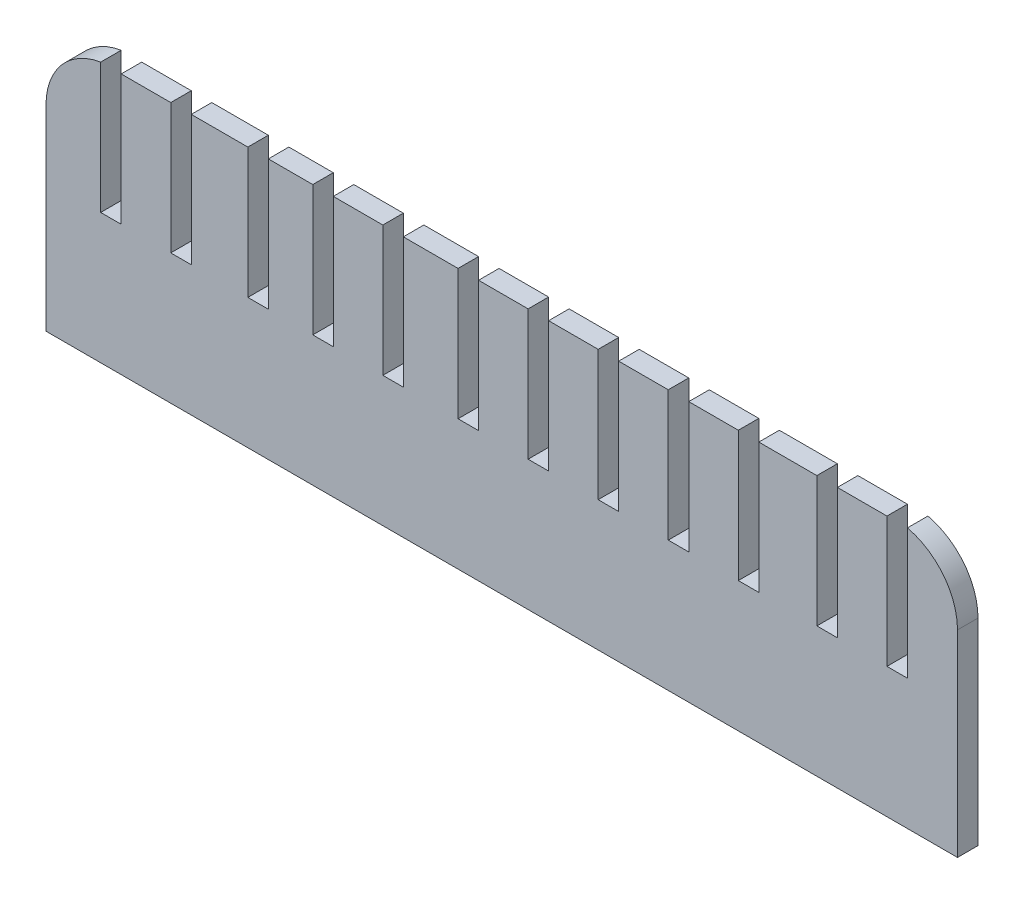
SolidWorks part; units mm, degrees
ref_plane "Front Plane" through (0, 0, 0) normal (0, 0, 1) x (1, 0, 0)
ref_plane "Top Plane" through (0, 0, 0) normal (0, 1, 0) x (1, 0, 0)
ref_plane "Right Plane" through (0, 0, 0) normal (1, 0, 0) x (0, 0, -1)
sketch "Sketch1" plane through (0, 0, 0) normal (0, 0, 1) x (1, 0, 0)
  line L0 (-50.8, 182.4249) -> (50.8, 182.4249)
  line L3 (-74.232, 233.2249) -> (-64.564, 233.2249)
  line L4 (-60.564, 233.2249) -> (-49.53, 233.2249)
  line L5 (-78.232, 233.2249) -> (-78.232, 207.8249)
  line L6 (-78.232, 207.8249) -> (-74.232, 207.8249)
  line L7 (-74.232, 233.2249) -> (-74.232, 207.8249)
  line L8 (61.468, 233.2249) -> (61.468, 207.8249)
  line L9 (-64.564, 233.2249) -> (-64.564, 207.8249)
  line L10 (-45.53, 233.2249) -> (-36.862, 233.2249)
  line L11 (-64.564, 207.8249) -> (-60.564, 207.8249)
  line L12 (-88.9, 182.4249) -> (-88.9, 233.2249)
  line L13 (-88.9, 233.2249) -> (-78.232, 233.2249)
  line L14 (88.9, 182.4249) -> (88.9, 233.2249)
  line L15 (-60.564, 233.2249) -> (-60.564, 207.8249)
  line L16 (61.468, 207.8249) -> (65.468, 207.8249)
  line L17 (-32.862, 233.2249) -> (-23.194, 233.2249)
  line L18 (-49.53, 233.2249) -> (-49.53, 207.8249)
  line L19 (-49.53, 207.8249) -> (-45.53, 207.8249)
  line L20 (-45.53, 233.2249) -> (-45.53, 207.8249)
  line L21 (-19.194, 233.2249) -> (-8.526, 233.2249)
  line L22 (-4.526, 233.2249) -> (5.142, 233.2249)
  line L23 (-36.862, 233.2249) -> (-36.862, 207.8249)
  line L24 (-36.862, 207.8249) -> (-32.862, 207.8249)
  line L25 (-32.862, 233.2249) -> (-32.862, 207.8249)
  line L26 (9.142, 233.2249) -> (18.81, 233.2249)
  line L27 (-23.194, 233.2249) -> (-23.194, 207.8249)
  line L28 (-23.194, 207.8249) -> (-19.194, 207.8249)
  line L29 (-19.194, 233.2249) -> (-19.194, 207.8249)
  line L30 (22.81, 233.2249) -> (32.478, 233.2249)
  line L31 (-8.526, 233.2249) -> (-8.526, 207.8249)
  line L32 (-8.526, 207.8249) -> (-4.526, 207.8249)
  line L33 (-4.526, 233.2249) -> (-4.526, 207.8249)
  line L34 (36.478, 233.2249) -> (46.146, 233.2249)
  line L35 (5.142, 233.2249) -> (5.142, 207.8249)
  line L36 (5.142, 207.8249) -> (9.142, 207.8249)
  line L37 (9.142, 233.2249) -> (9.142, 207.8249)
  line L38 (50.146, 233.2249) -> (61.468, 233.2249)
  line L39 (18.81, 233.2249) -> (18.81, 207.8249)
  line L40 (18.81, 207.8249) -> (22.81, 207.8249)
  line L41 (22.81, 233.2249) -> (22.81, 207.8249)
  line L42 (65.468, 233.2249) -> (75.136, 233.2249)
  line L43 (32.478, 233.2249) -> (32.478, 207.8249)
  line L44 (32.478, 207.8249) -> (36.478, 207.8249)
  line L45 (36.478, 233.2249) -> (36.478, 207.8249)
  line L46 (79.136, 233.2249) -> (88.9, 233.2249)
  line L47 (46.146, 233.2249) -> (46.146, 207.8249)
  line L48 (46.146, 207.8249) -> (50.146, 207.8249)
  line L49 (50.146, 233.2249) -> (50.146, 207.8249)
  line L50 (50.8, 182.4249) -> (88.9, 182.4249)
  line L51 (65.468, 233.2249) -> (65.468, 207.8249)
  line L52 (75.136, 233.2249) -> (75.136, 207.8249)
  line L53 (-50.8, 182.4249) -> (-88.9, 182.4249)
  line L54 (75.136, 207.8249) -> (79.136, 207.8249)
  line L55 (79.136, 233.2249) -> (79.136, 207.8249)
  point P0 (0, 0)
extrude "Boss-Extrude1" add sketch "Sketch1" along normal blind 4
fillet "Fillet2" radius 12.7 1 edges at (-88.9, 233.2249, 2)
fillet "Fillet3" radius 12.7 1 edges at (88.9, 233.2249, 2)
sketch "Sketch2" plane through (0, 0, 0) normal (0, 0, 1) x (1, 0, 0)
equation "\"major-height\"= 7in"
equation "\"major-teeth-height\"= 5in"
equation "\"minor-height\"= 2in"
equation "\"minor-teeth height\"= 1in"
equation "\"distance-between-teeth\"= 0.42"
equation "\"sheet-thickness\"= 4mm"
equation "\"width\"= 7in"
equation "\"D1@Boss-Extrude1\"=\"sheet-thickness\""
equation "\"edges\"= 0.5in"
equation "\"D1@Fillet1\"=\"edges\""
equation "\"D1@Fillet2\"=\"edges\""
equation "\"D5@Sketch1\"=\"sheet-thickness\""
equation "\"D6@Sketch1\"=\"minor-teeth height\""
equation "\"D11@Sketch1\"=\"sheet-thickness\""
equation "\"D13@Sketch1\"=\"sheet-thickness\""
equation "\"D14@Sketch1\"=\"minor-teeth height\""
equation "\"D15@Sketch1\"=\"sheet-thickness\""
equation "\"D16@Sketch1\"=\"minor-teeth height\""
equation "\"D17@Sketch1\"=\"sheet-thickness\""
equation "\"D18@Sketch1\"=\"minor-teeth height\""
equation "\"D19@Sketch1\"=\"sheet-thickness\""
equation "\"D20@Sketch1\"=\"minor-teeth height\""
equation "\"D21@Sketch1\"=\"sheet-thickness\""
equation "\"D22@Sketch1\"=\"minor-teeth height\""
equation "\"D23@Sketch1\"=\"sheet-thickness\""
equation "\"D24@Sketch1\"=\"minor-teeth height\""
equation "\"D1@Fillet3\"=\"edges\""
equation "\"D3@Sketch1\"=\"minor-teeth height\""
equation "\"D4@Sketch1\"=\"sheet-thickness\""
equation "\"D7@Sketch1\"=\"sheet-thickness\""
equation "\"D8@Sketch1\"=\"minor-teeth height\""
equation "\"D9@Sketch1\"=\"sheet-thickness\""
equation "\"D10@Sketch1\"=\"minor-teeth height\""
equation "\"D25@Sketch1\"=\"sheet-thickness\""
equation "\"D26@Sketch1\"=\"minor-teeth height\""
